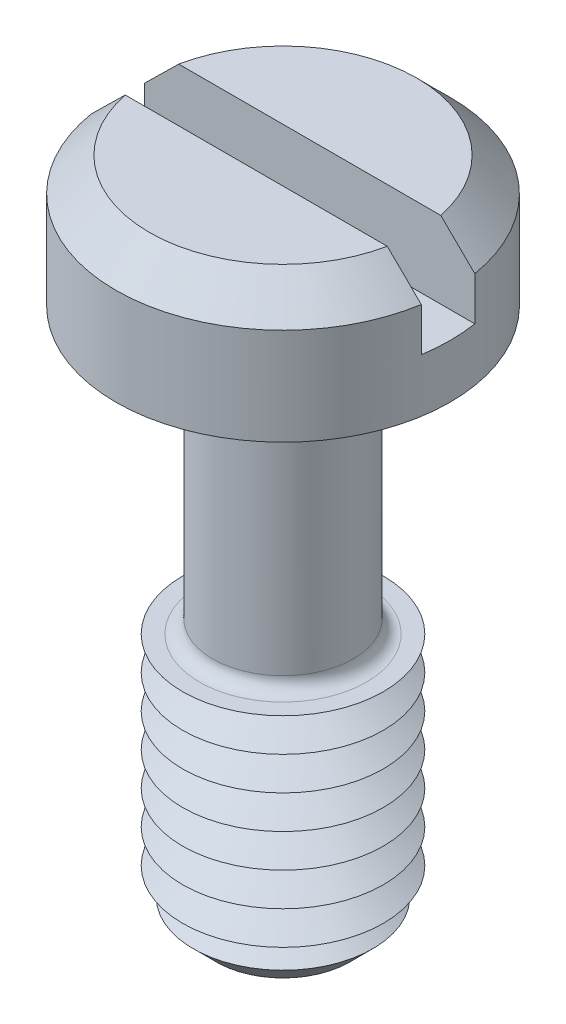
SolidWorks part; units mm, degrees
ref_plane "Front Plane" through (0, 0, 0) normal (0, 0, 1) x (1, 0, 0)
ref_plane "Top Plane" through (0, 0, 0) normal (0, 1, 0) x (1, 0, 0)
ref_plane "Right Plane" through (0, 0, 0) normal (1, 0, 0) x (0, 0, -1)
sketch "Sketch1" plane through (0, 0, 0) normal (0, 1, 0) x (1, 0, 0)
  circle A0 centre (0, 0) radius 5
  dimension "D1" = 10
extrude "Boss-Extrude1" add sketch "Sketch1" along normal blind 3.9
sketch "Sketch2" plane through (0, 0, 0) normal (0, -1, 0) x (1, 0, 0)
  circle A0 centre (0, 0) radius 2.1
  dimension "D1" = 4.2
extrude "Boss-Extrude2" add sketch "Sketch2" along normal blind 16
sketch "Sketch3" plane through (0, -16, 0) normal (0, -1, 0) x (1, 0, 0)
  circle A0 centre (0, 0) radius 3
  dimension "D1" = 6
extrude "Boss-Extrude3" add sketch "Sketch3" against normal blind 7.5
chamfer "Chamfer1" distance 1 angle 45 1 edges at (0, -16, -3)
sketch "Sketch4" plane through (0, 0, 0) normal (1, 0, 0) x (0, 0, -1)
  line L0 (0, -6.5871) -> (0, -12.0372) construction
sketch "Sketch5" plane through (0, 0, 0) normal (1, 0, 0) x (0, 0, -1)
  line L0 (-3, -8.5) -> (-2.134, -9)
  line L1 (-2.134, -9) -> (-3, -9.5)
  line L2 (-3, -8.5) -> (-3, -15) construction
  line L3 (-3, -9.5) -> (-3, -8.5)
  dimension "D1" = 1
revolve "Cut-Revolve1" cut sketch "Sketch5" angle 360 about L0
pattern_linear "LPattern1" count 7 spacing 1 along (0, -1, 0) of "Cut-Revolve1"
fillet "Fillet1" radius 0.4 2 edges at (0, -8.5, -2.1) (0, 0, -2.1)
chamfer "Chamfer2" distance 1 angle 45 1 edges at (0, 3.9, 5)
sketch "Sketch6" plane through (0, 3.9, 0) normal (0, 1, 0) x (1, 0, 0)
  line L1 (5, -0.8) -> (-5, -0.8)
  line L2 (5, -0.8) -> (5, 0.8)
  line L3 (5, 0.8) -> (-5, 0.8)
  line L4 (-5, -0.8) -> (-5, 0.8)
  line L5 (5, -0.8) -> (-5, 0.8) construction
  line L6 (5, 0.8) -> (-5, -0.8) construction
  circle A0 centre (0, 0) radius 5 construction
  point P0 (0, 0)
  dimension "D1" = 1.6
extrude "Cut-Extrude1" cut sketch "Sketch6" against normal blind 2.3
